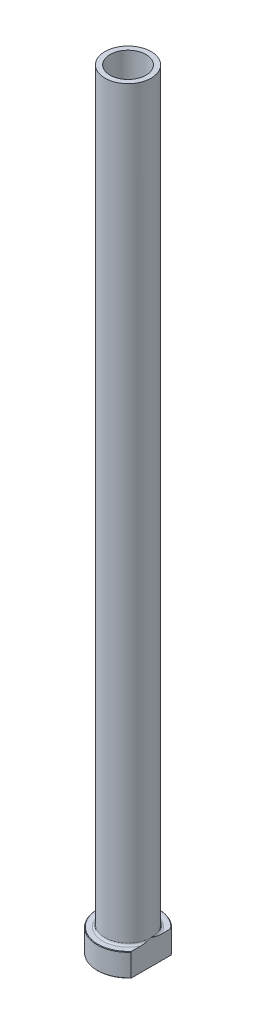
SolidWorks part; units mm, degrees
ref_plane "Front Plane" through (0, 0, 0) normal (0, 0, 1) x (1, 0, 0)
ref_plane "Top Plane" through (0, 0, 0) normal (0, 1, 0) x (1, 0, 0)
ref_plane "Right Plane" through (0, 0, 0) normal (1, 0, 0) x (0, 0, -1)
sketch "Sketch1" plane through (0, 0, 0) normal (0, 0, 1) x (1, 0, 0)
  line L0 (-7, 300) -> (-9, 300)
  line L1 (-9, 300) -> (-9, 9)
  line L2 (-9, 9) -> (-12, 9)
  line L3 (-12, 9) -> (-12, 0)
  line L4 (11.55, 0) -> (-11.55, 0) construction
  line L5 (-12, 0) -> (-7.25, 0)
  line L6 (-7, 245) -> (-7, 300)
  line L7 (0, 92.1877) -> (0, -15.5353) construction
  line L8 (0, -13.2) -> (0, 13.2) construction
  line L9 (-7, 245) -> (-7.25, 233)
  line L10 (-7.25, 233) -> (-7.25, 0)
  dimension "D1" = 0.25
  dimension "ID" = 14
  dimension "OD" = 18
  dimension "L" = 300
  dimension "H" = 24
  dimension "T" = 9
  dimension "N" = 55
  dimension "D2" = 12
  dimension "L-N" = 245
revolve "Revolve1" add sketch "Sketch1" angle 360 about L7
fillet "Fillet1" radius 0.8 1 edges at (0, 9, 9)
chamfer "Chamfer1" distance 0.2 angle 45 2 edges at (0, 9, 12) (0, 0, 12)
sketch "Sketch2" plane through (0, 0, 0) normal (0, -1, 0) x (1, 0, 0)
  line L0 (9, 7.9373) -> (9, -7.9373)
  circle A0 centre (0, 0) radius 12 construction
  arc A1 (9, 7.9373) -> (9, -7.9373) centre (0, 0) cw
  circle A2 centre (0, 0) radius 9 construction
extrude "Cut-Extrude1" cut sketch "Sketch2" against normal through all
chamfer "Chamfer2" distance 0.5 angle 45 1 edges at (0, 0, 7.25)
